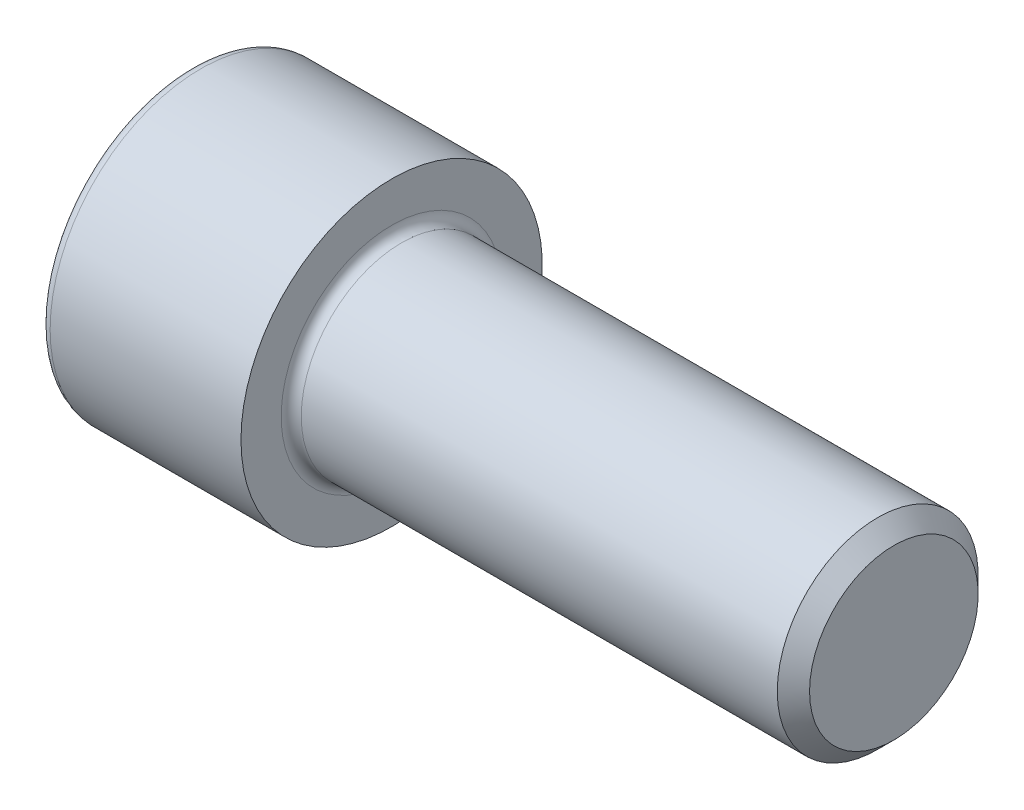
SolidWorks part; units mm, degrees
ref_plane "Plane1" through (0, 0, 0) normal (0, 0, 1) x (1, 0, 0)
ref_plane "Plane2" through (0, 0, 0) normal (0, 1, 0) x (1, 0, 0)
ref_plane "Plane3" through (0, 0, 0) normal (1, 0, 0) x (0, 0, -1)
sketch "BodySke" plane through (0, 0, 0) normal (0, 0, 1) x (1, 0, 0)
  line L0 (0, 0) -> (0, 9)
  line L1 (0, 9) -> (12, 9)
  line L2 (12, 9) -> (12, 6)
  line L3 (12, 6) -> (41.036, 6)
  line L4 (42, 5.036) -> (42, 0)
  line L5 (42, 0) -> (0, 0)
  line L6 (-31.75, 0) -> (127, 0) construction
  line L8 (42, 5.036) -> (41.036, 6)
  line L10 (42, -5.036) -> (41.036, -6) construction
  line L11 (13.75, 9.525) -> (13.75, 3.175) construction
  line L12 (12, 9.525) -> (12, 3.175) construction
  line L13 (-18, 9.525) -> (-18, 3.175) construction
  dimension "Diameter" = 12
  dimension "Head_ht" = 12
  dimension "Length" = 30
  dimension "Body_ch_ang" = 45
  dimension "Head_dia" = 18
  dimension "Minor_dia" = 10.072
  dimension "Advance" = 1.75
  dimension "Thread_nom" = 30
  dimension "Thread_length" = 60
revolve "Base-Revolve" add sketch "BodySke"
fillet "Fillet1" radius 0.6 1 edges at (12, 0, 6)
fillet "Fillet2" radius 0.6 1 edges at (0, 0, 9)
sketch "Sketch2" plane through (0, 0, 0) normal (0, 0, 1) x (1, 0, 0)
  line L0 (0, 5.0575) -> (6, 5.0575)
  line L1 (6, 5.0575) -> (8.9199, 0)
  line L2 (-31.75, 0) -> (127, 0) construction
  line L3 (8.9199, 0) -> (0, 0)
  line L4 (0, 0) -> (0, 5.0575)
  line L6 (0, 0) -> (47.625, 0) construction
  dimension "D1" = 5.0575
  dimension "D2" = 60
  dimension "Depth" = 6
revolve "Hex-PreBroach" cut sketch "Sketch2" angle 360 about L6
sketch "Sketch3" plane through (0, 0, 0) normal (-1, 0, 0) x (0, 0.5, 0.866)
  line L0 (2.9199, 5.0575) -> (-2.9199, 5.0575)
  line L1 (-2.9199, 5.0575) -> (-5.8399, 0)
  line L2 (2.9199, 5.0575) -> (5.8399, 0)
  line L3 (2.9199, -5.0575) -> (5.8399, 0)
  line L4 (2.9199, -5.0575) -> (-2.9199, -5.0575)
  line L5 (-2.9199, -5.0575) -> (-5.8399, 0)
  dimension "D1" = 5.0575
  dimension "D2" = 5.0575
  dimension "Hex_size" = 10.115
extrude "Hex" cut sketch "Sketch3" against normal blind 6
sketch "ThdSchSke" plane through (0, 0, 0) normal (0, 0, 1) x (1, 0, 0)
  line L0 (17.25, -5.036) -> (16.575, -6)
  line L1 (17.25, -5.036) -> (17.925, -6)
  line L2 (17.925, -6) -> (17.925, -7.5)
  line L3 (-3.175, 0) -> (5.1513, 0) construction
  line L4 (0, 8.4) -> (0, -8.4) construction
  line L5 (17.925, -7.5) -> (16.575, -7.5)
  line L6 (16.575, -7.5) -> (16.575, -6)
  dimension "Thread_minor" = 10.072
  dimension "Diameter" = 12
  dimension "Start" = 17.25
  dimension "SideAngle" = 55
  dimension "VeeAngle" = 70
  dimension "Overcut" = 15
revolve "ThreadSchematic" [suppressed] cut sketch "ThdSchSke" angle 360 about L3
pattern_linear "ThdSchPat" [suppressed]
equation "\"D2@Sketch3\" = \"Hex_size@Sketch3\" / 2"
equation "\"D1@Sketch3\" = \"Hex_size@Sketch3\" / 2"
equation "\"D1@Sketch2\" = \"Hex_size@Sketch3\" / 2"
equation "\"Thread_minor@ThreadCosmetic\"  =  \"Minor_dia@BodySke\""
equation "\"Depth@Sketch2\" =  \"Key_eng@Hex\""
equation "\"Thread_length@ThreadCosmetic\" = ((sgn( (\"Length@BodySke\" - \"Advance@BodySke\" * 3.0) - \"Thread_nom@BodySke\" )-1)*( (\"Length@BodySke\" - \"Advance@BodySke\" * 3.0) - \"Thread_nom@BodySke\" ))/-2+ \"Thread_no"
equation "\"Thread_minor@ThdSchSke\" = \"Minor_dia@BodySke\""
equation "\"Diameter@ThdSchSke\" = \"Diameter@BodySke\""
equation "\"Overcut@ThdSchSke\" = \"Diameter@BodySke\" * 1.25"
equation "\"Start@ThdSchSke\" = \"Head_ht@BodySke\" + \"Length@BodySke\" - \"Thread_length@ThreadCosmetic\"  '---Non-countersunk---"
equation "\"Num_threads@ThdSchPat\" = int( \"Thread_length@ThreadCosmetic\" / \"Advance@BodySke\" + 0.999 )  + 1"
equation "\"Advance@ThdSchPat\" = \"Thread_length@ThreadCosmetic\" /  (\"Num_threads@ThdSchPat\" - 1) 'relax it"
equation "\"Num_threads@ThdSchPat\" = \"Num_threads@ThdSchPat\" - sgn( \"Num_threads@ThdSchPat\" - 1) '---chamfered tips only---"
